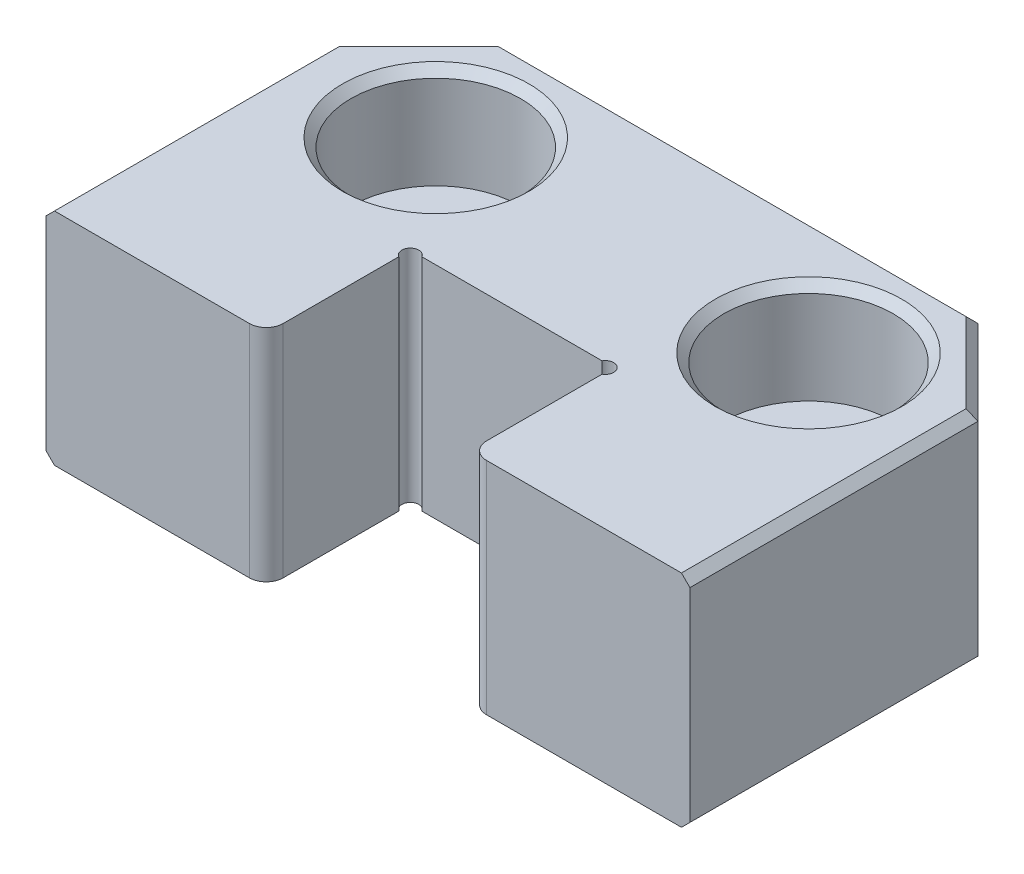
SolidWorks part; units mm, degrees
ref_plane "Front Plane" through (0, 0, 0) normal (0, 0, 1) x (1, 0, 0)
ref_plane "Top Plane" through (0, 0, 0) normal (0, 1, 0) x (1, 0, 0)
ref_plane "Right Plane" through (0, 0, 0) normal (1, 0, 0) x (0, 0, -1)
sketch "Sketch2" plane through (0, 0, 0) normal (0, 1, 0) x (1, 0, 0)
  line L0 (-55, 0) -> (55, 0) construction
  line L1 (-19, 22) -> (19, 22)
  line L2 (-19, 22) -> (-19, 0)
  line L3 (-19, 0) -> (-6, 0)
  line L4 (19, 22) -> (19, 0)
  line L5 (-6, 0) -> (-6, 7.817)
  line L6 (-5.317, 8.5) -> (5.317, 8.5)
  line L7 (6, 7.817) -> (6, 0)
  line L8 (19, 0) -> (6, 0)
  circle A0 centre (11, 15) radius 2.9
  circle A1 centre (-11, 15) radius 2.9
  arc A2 (6, 7.817) -> (5.317, 8.5) centre (5.75, 8.25) ccw
  arc A3 (-5.317, 8.5) -> (-6, 7.817) centre (-5.75, 8.25) ccw
  dimension "D11" = 5.8
  dimension "D12" = 5.8
  dimension "D15" = 1
  dimension "D18" = 1
  dimension "D1" = 38
  dimension "D2" = 22
  dimension "D3" = 19
  dimension "D4" = 8.5
  dimension "D5" = 6
  dimension "D6" = 12
  dimension "D7" = 8
  dimension "D8" = 8
  dimension "D9" = 7
  dimension "D10" = 7
  dimension "D13" = 0.25
  dimension "D14" = 0.25
  dimension "D16" = 0.25
  dimension "D17" = 0.25
extrude "Extrude1" add sketch "Sketch2" against normal blind 13
chamfer "Chamfer1" distance 5 angle 45 2 edges at (-19, -6.5, -22) (19, -6.5, -22)
fillet "Fillet1" radius 1 2 edges at (6, -6.5, 0) (-6, -6.5, 0)
sketch "Sketch3" plane through (0, 0, 0) normal (0, 1, 0) x (1, 0, 0)
  circle A1 centre (-11, 15) radius 5
  dimension "D1" = 10
extrude "Cut-Extrude1" cut sketch "Sketch3" against normal blind 6
mirror "Mirror1" about plane through (0, 0, 0) normal (1, 0, 0) of "Cut-Extrude1"
chamfer "Chamfer2" distance 0.5 angle 45 10 edges at (-19, -13, -8.5) (-16.5, -13, -19.5) (0, -13, -22) (16.5, -13, -19.5) (19, -13, -8.5) (-19, 0, -8.5) (-16.5, 0, -19.5) (0, 0, -22) (16.5, 0, -19.5) (19, 0, -8.5)
chamfer "Chamfer3" distance 0.5 angle 45 2 edges at (11, 0, -10) (-11, 0, -10)
